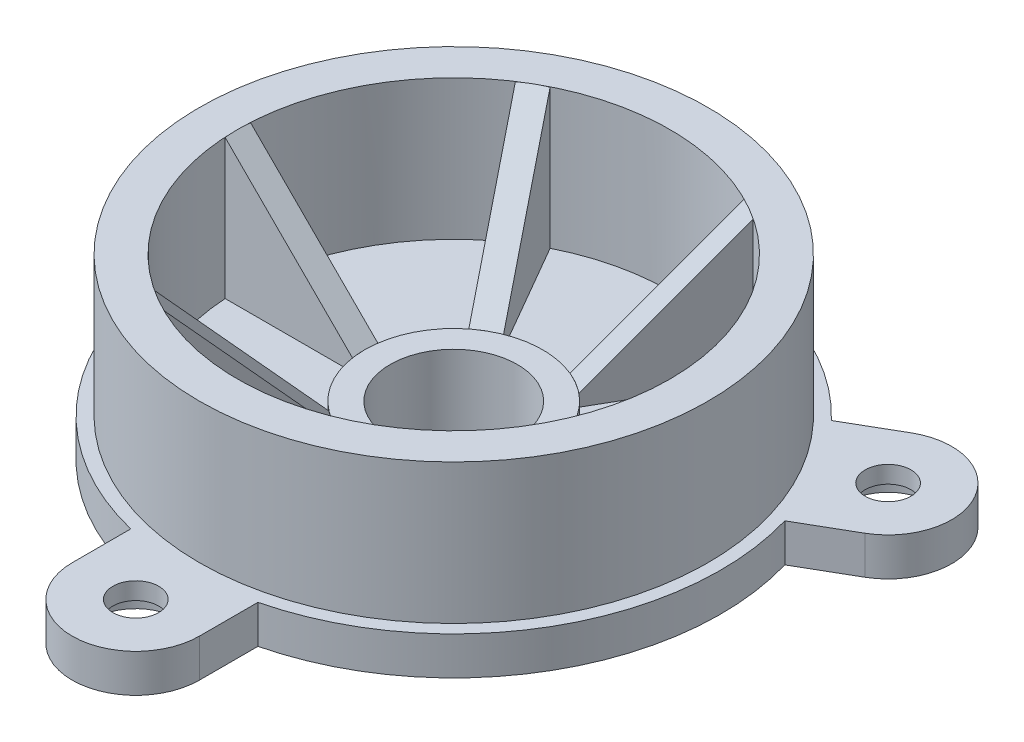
SolidWorks part; units mm, degrees
ref_plane "Front Plane" through (0, 0, 0) normal (0, 0, 1) x (1, 0, 0)
ref_plane "Top Plane" through (0, 0, 0) normal (0, 1, 0) x (1, 0, 0)
ref_plane "Right Plane" through (0, 0, 0) normal (1, 0, 0) x (0, 0, -1)
sketch "Sketch1" plane through (0, 0, 0) normal (0, 0, 1) x (1, 0, 0)
  line L0 (0, 91.9243) -> (0, 0) construction
  line L1 (5, 0) -> (5, 6)
  line L2 (5, 6) -> (7, 6)
  line L3 (7, 6) -> (7, 5)
  line L4 (7, 5) -> (17, 5)
  line L5 (17, 5) -> (17, 16)
  line L6 (17, 16) -> (20, 16)
  line L7 (20, 16) -> (20, 5)
  line L8 (20, 5) -> (21, 5)
  line L9 (21, 5) -> (21, 2)
  line L10 (21, 2) -> (10, 2)
  line L11 (10, 2) -> (10, 0)
  line L12 (10, 0) -> (5, 0)
  dimension "D1" = 10
  dimension "D2" = 20
  dimension "D3" = 2
  dimension "D4" = 2
  dimension "D5" = 6
  dimension "D6" = 34
  dimension "D7" = 40
  dimension "D8" = 42
  dimension "D9" = 3
  dimension "D10" = 11
revolve "Revolve1" add sketch "Sketch1" angle 360 about L0
sketch "Sketch2" plane through (0, 5, 0) normal (0, 1, 0) x (1, 0, 0)
  line L0 (0, 0) -> (0, -25) construction
  line L1 (-5, -19.3649) -> (-5, -25)
  line L2 (5, -25) -> (5, -19.3649)
  circle A0 centre (0, 0) radius 20 construction
  arc A1 (-5, -19.3649) -> (5, -19.3649) centre (0, 0) ccw
  arc A2 (-5, -25) -> (5, -25) centre (0, -25) ccw
  circle A3 centre (0, 0) radius 25 construction
  dimension "D1" = 5
  dimension "D2" = 50
extrude "Boss-Extrude1" add sketch "Sketch2" against normal up to surface (3 mm away)
hole_wizard "CBORE for M3 SBHCS1" positions "Sketch4" profile "Sketch3" counterbore size "M3" standard "Ansi Metric"
sketch "Sketch4" plane through (0, 2, 0) normal (0, -1, 0) x (1, 0, 0)
  arc A0 (5, 25) -> (-5, 25) centre (0, 25) ccw construction
  point P0 (0, 25)
sketch "Sketch3" plane through (0, 2, 25) normal (1, 0, 0) x (0, 0, -1)
  line L0 (0, 0) -> (0, 14)
  line L1 (0, 14) -> (1.8, 14)
  line L3 (1.8, 14) -> (1.8, 1.65)
  line L4 (1.8, 1.65) -> (3.35, 1.65)
  line L5 (3.35, 1.65) -> (3.35, 0)
  line L7 (3.35, 0) -> (0, 0)
  line L11 (0, -6.35) -> (0, 107.95) construction
  dimension "Thru Hole Dia." = 3.6
  dimension "Thru Hole Depth" = 14
  dimension "C'Bore Dia." = 6.7
  dimension "C'Bore Depth" = 1.65
pattern_circular "CirPattern1" count 3 over 360 about axis through (0, 0, 0) along (0, 1, 0) of "CBORE for M3 SBHCS1", "Boss-Extrude1"
sketch "Sketch5" plane through (0, 0, 0) normal (0, 0, 1) x (1, 0, 0)
  line L0 (-17, 16) -> (-7, 6)
  line L1 (7, 6) -> (-7, 6) construction
  line L2 (-7, 6) -> (-7, 5) construction
rib "Rib1" sketch "Sketch5" sketch "Sketch5" thickness 2 extrusion direction parallel to sketch draft on no parameters "D1"=2
pattern_circular "CirPattern2" count 6 over 360 about axis through (0, 0, 0) along (0, 1, 0) of "Rib1"
